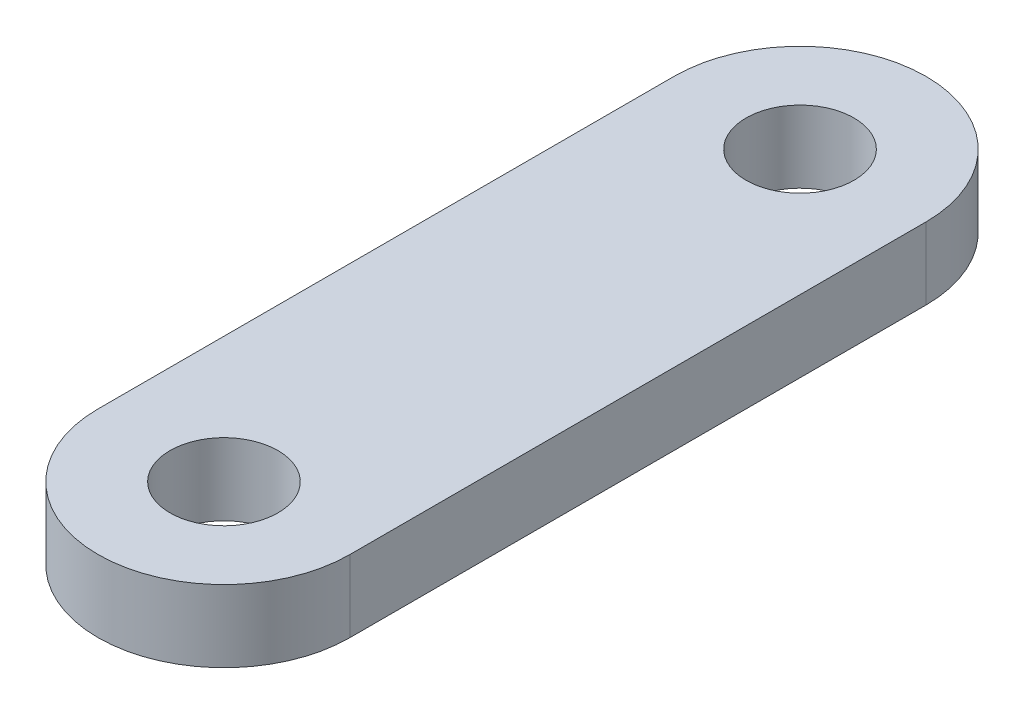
SolidWorks part; units mm, degrees
ref_plane "Front" through (0, 0, 0) normal (0, 0, 1) x (1, 0, 0)
ref_plane "Top" through (0, 0, 0) normal (0, 1, 0) x (1, 0, 0)
ref_plane "Right" through (0, 0, 0) normal (1, 0, 0) x (0, 0, -1)
sketch "Sketch1" plane through (0, 0, 0) normal (0, 1, 0) x (1, 0, 0)
  line L0 (0, 9.5) -> (-7.5377, 9.5) construction
  line L1 (-3.5, 8) -> (3.5, 8) construction
  line L2 (-3.5, 8) -> (-3.5, 0)
  line L3 (-3.5, 0) -> (3.5, 0)
  line L4 (3.5, 8) -> (3.5, 0)
  line L5 (0, 11.5) -> (-7.5377, 11.5) construction
  circle A0 centre (0, 8) radius 1.5
  arc A1 (-3.5, 8) -> (3.5, 8) centre (0, 8) cw
  point P4 (0, 0)
  dimension "D1" = 3
  dimension "D2" = 2
  dimension "D3" = 8
extrude "Boss-Extrude1" add sketch "Sketch1" along normal blind 2
mirror "Mirror1" about plane through (-3.5, 2, 0) normal (0, 0, -1)
